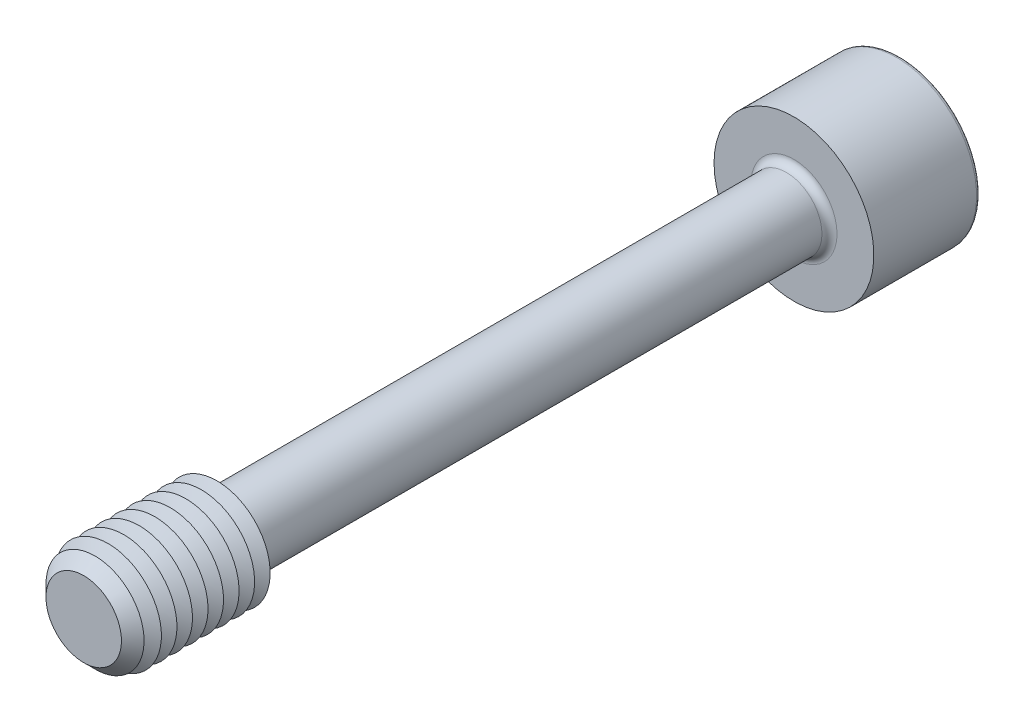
SolidWorks part; units mm, degrees
ref_plane "Front Plane" through (0, 0, 0) normal (0, 0, 1) x (1, 0, 0)
ref_plane "Top Plane" through (0, 0, 0) normal (0, 1, 0) x (1, 0, 0)
ref_plane "Right Plane" through (0, 0, 0) normal (1, 0, 0) x (0, 0, -1)
sketch "Sketch1" plane through (0, 0, 0) normal (0, 0, 1) x (1, 0, 0)
  circle A0 centre (0, 0) radius 4
  dimension "D1" = 8
extrude "Extrude1" add sketch "Sketch1" along normal mid plane 80
sketch "Sketch2" plane through (0, 0, 0) normal (1, 0, 0) x (0, 0, -1)
  line L0 (-40, 0) -> (-40, 6)
  line L1 (-40, 4) -> (-40, -4) construction
  line L2 (-40, 6) -> (-25, 6)
  line L3 (-25, 6) -> (-23.8453, 4)
  line L4 (40, 4) -> (-40, 4) construction
  line L5 (-23.8453, 4) -> (-23.8453, 0)
  line L6 (-23.8453, 0) -> (-40, 0)
  dimension "D1" = 6
  dimension "D2" = 120
  dimension "D3" = 15
revolve "Revolve1" add sketch "Sketch2" angle 360 about L6
chamfer "Chamfer1" distance 1.75 angle 45 1 edges at (0, 6, 40)
sketch "Sketch3" plane through (0, 0, -40) normal (0, 0, -1) x (-1, 0, 0)
  circle A0 centre (0, 0) radius 9
  dimension "D1" = 18
extrude "Extrude2" add sketch "Sketch3" along normal blind 12
sketch "Sketch4" plane through (-13.7, 0, -52) normal (0, 0, 1) x (1, 0, 0)
  line L2 (10.8132, -5) -> (16.5868, -5)
  line L3 (16.5868, -5) -> (19.4735, 0)
  line L4 (19.4735, 0) -> (16.5868, 5)
  line L6 (16.5868, 5) -> (10.8132, 5)
  line L7 (10.8132, 5) -> (7.9265, 0)
  line L8 (7.9265, 0) -> (10.8132, -5)
  circle A0 centre (13.7, 0) radius 5 construction
  dimension "D1" = 10
extrude "Extrude3" cut sketch "Sketch4" along normal blind 10
fillet "Fillet1" radius 0.85 1 edges at (-4, 0, -40)
fillet "Fillet2" radius 0.425 1 edges at (-9, 0, -52)
sketch "Sketch5" plane through (0, 0, 0) normal (1, 0, 0) x (0, 0, -1)
  line L0 (42, 0) -> (42, -5)
  line L1 (42, -5) -> (39.1132, 0)
  line L2 (39.1132, 0) -> (42, 0)
  dimension "D1" = 30
revolve "Cut-Revolve1" cut sketch "Sketch5" angle 360 about L2
sketch "Sketch6" plane through (0, 0, 0) normal (1, 0, 0) x (0, 0, -1)
  line L0 (1.332, 0) -> (-13.289, 0) construction
sketch "Sketch7" plane through (0, 0, 0) normal (1, 0, 0) x (0, 0, -1)
  line L0 (-25, 6) -> (-25.875, 4.4845)
  line L1 (-25.875, 4.4845) -> (-26.75, 6)
  line L2 (-25, 6) -> (-38.25, 6) construction
  line L3 (-26.75, 6) -> (-25, 6)
  dimension "D1" = 1.75
revolve "Cut-Revolve2" cut sketch "Sketch7" angle 360 about L0
pattern_linear "LPattern1" count 8 spacing 1.75 along (0, 0, 1) of "Cut-Revolve2"
